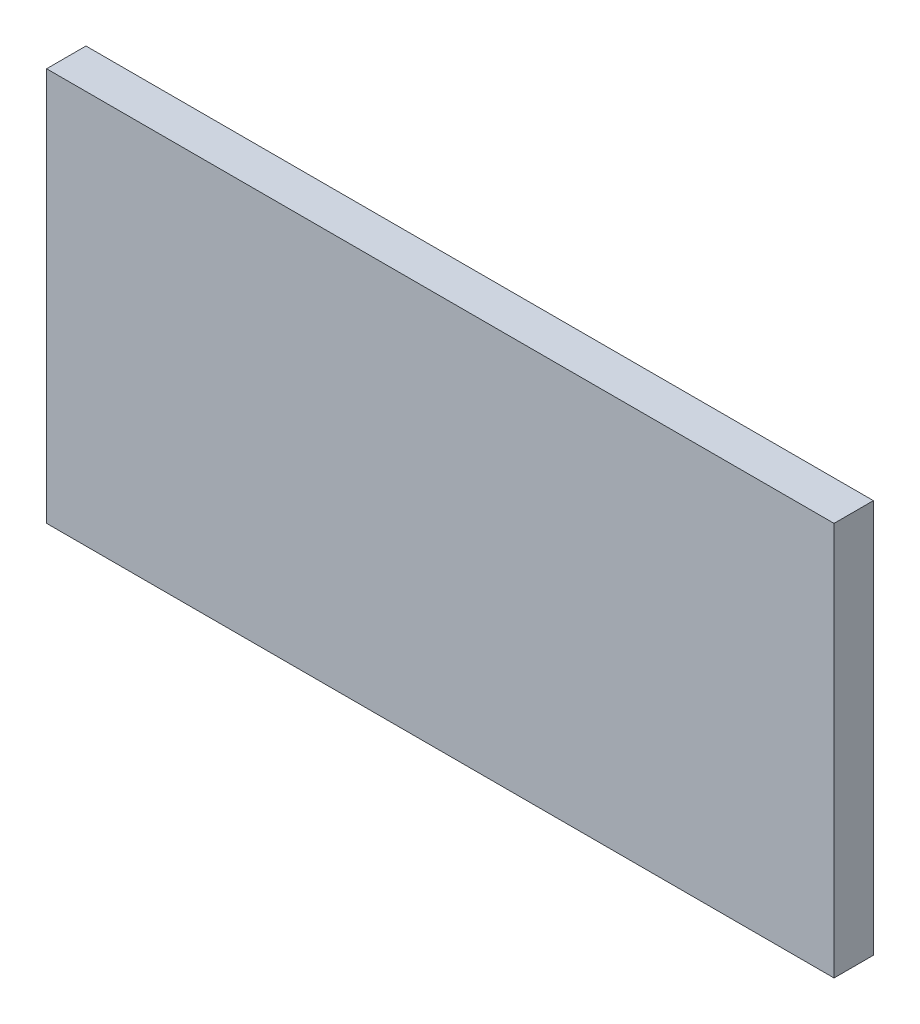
SolidWorks part; units mm, degrees
ref_plane "Front Plane" through (0, 0, 0) normal (0, 0, 1) x (1, 0, 0)
ref_plane "Top Plane" through (0, 0, 0) normal (0, 1, 0) x (1, 0, 0)
ref_plane "Right Plane" through (0, 0, 0) normal (1, 0, 0) x (0, 0, -1)
sketch "Sketch1" plane through (0, 0, 0) normal (0, 0, 1) x (1, 0, 0)
  line L1 (100, -50) -> (-100, -50)
  line L2 (100, -50) -> (100, 50)
  line L3 (100, 50) -> (-100, 50)
  line L4 (-100, -50) -> (-100, 50)
  line L5 (100, -50) -> (-100, 50) construction
  line L6 (100, 50) -> (-100, -50) construction
  point P0 (0, 0)
  dimension "D1" = 200
  dimension "D2" = 100
extrude "Boss-Extrude1" add sketch "Sketch1" along normal blind 10
